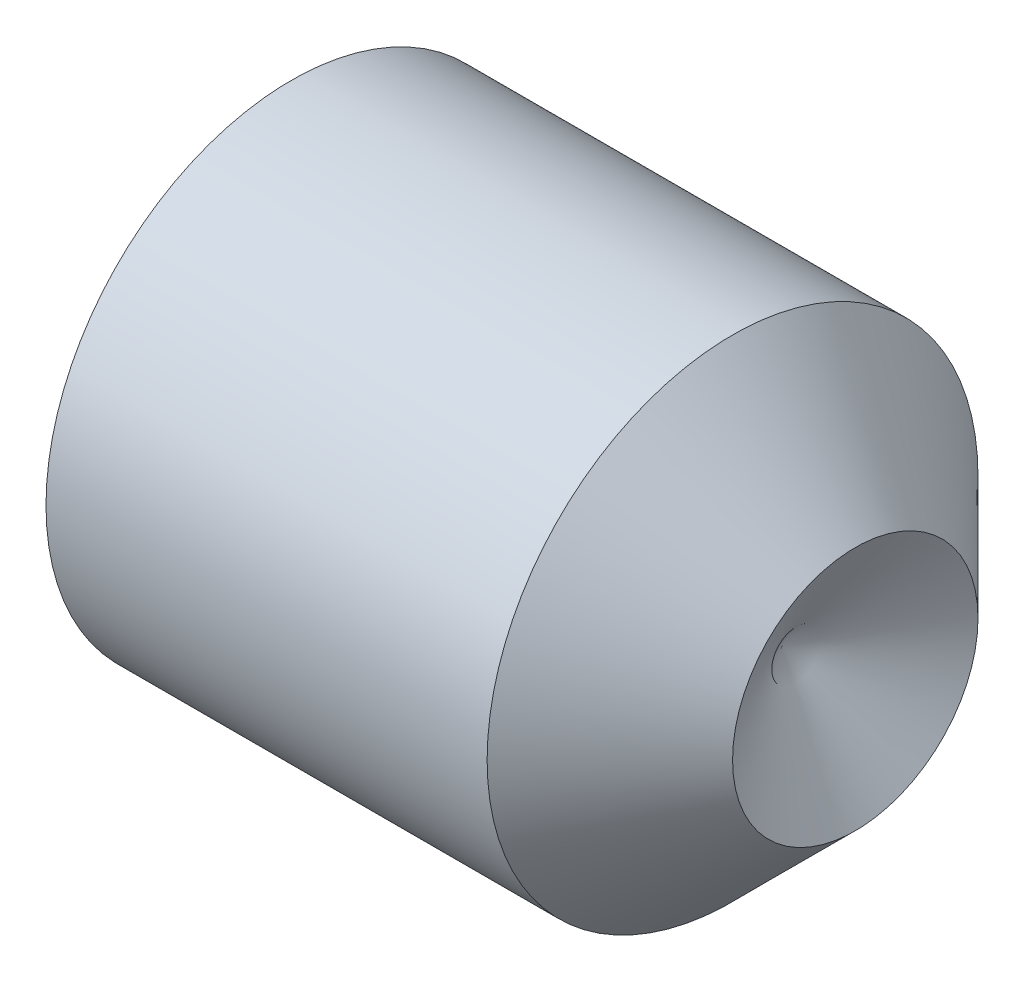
SolidWorks part; units mm, degrees
ref_plane "Plane1" through (0, 0, 0) normal (0, 0, 1) x (1, 0, 0)
ref_plane "Plane2" through (0, 0, 0) normal (0, 1, 0) x (1, 0, 0)
ref_plane "Plane3" through (0, 0, 0) normal (1, 0, 0) x (0, 0, -1)
revolve "BaseBody" add sketch "BodySke" angle 360 about L5
sketch "BodySke" plane through (0, 0, 0) normal (0, 0, 1) x (1, 0, 0)
  line L0 (0, 0) -> (0, 2.055)
  line L1 (0, 2.055) -> (0.2569, 2.5)
  line L2 (0.2569, 2.5) -> (4.75, 2.5)
  line L3 (4.75, 2.5) -> (6, 1.25)
  line L4 (5.2489, 0) -> (0, 0)
  line L5 (-12.7, 0) -> (88.9, 0) construction
  line L6 (5.2489, 0) -> (6, 1.25)
  line L7 (6, 1.25) -> (6, 10.775) construction
  line L8 (0, -2.055) -> (0.2569, -2.5) construction
  line L9 (5.2489, 0) -> (6, -1.25) construction
  line L10 (4.75, -2.5) -> (6, -1.25) construction
  line L11 (0.8, 15.875) -> (0.8, -3.175) construction
  dimension "Length" = 6
  dimension "Diameter" = 5
  dimension "Drive_ch_ang" = 60
  dimension "Minor_dia" = 4.11
  dimension "Cup_nose_ang" = 45
  dimension "Cup_ang" = 118
  dimension "Cup_dia" = 2.5
  dimension "Advance" = 0.8
sketch "Sketch2" plane through (0, 0, 0) normal (-1, 0, 0) x (0, 0, 1)
  line L0 (0.7217, 1.25) -> (-0.7217, 1.25)
  line L1 (-0.7217, 1.25) -> (-1.4434, 0)
  line L2 (0.7217, 1.25) -> (1.4434, 0)
  line L3 (0.7217, -1.25) -> (1.4434, 0)
  line L4 (0.7217, -1.25) -> (-0.7217, -1.25)
  line L5 (-0.7217, -1.25) -> (-1.4434, 0)
  dimension "Hex_size" = 2.5
  dimension "D2" = 1.25
  dimension "D3" = 1.25
extrude "Hex" cut sketch "Sketch2" against normal blind 2.7
sketch "Sketch4" plane through (0, 4.7709, -0.5249) normal (-1, 0, 0) x (0, 0, 1)
  line L0 (0.5249, -4.7709) -> (1.9854, -4.7709)
  line L1 (0.5249, -4.7709) -> (6.6732, -1.2211) construction
  line L2 (0.5249, -4.7709) -> (1.2551, -3.506)
  line L3 (1.7257, -4.4442) -> (1.9182, -4.333)
  line L4 (1.4082, -3.8943) -> (1.6007, -3.7831)
  arc A0 (1.7257, -4.4442) -> (1.4082, -3.8943) centre (0.5249, -4.7709) ccw
  arc A1 (1.9854, -4.7709) -> (1.9182, -4.333) centre (0.5249, -4.7709) ccw
  arc A2 (1.2551, -3.506) -> (1.6007, -3.7831) centre (0.5249, -4.7709) cw
  circle A3 centre (0.5249, -4.7709) radius 1.2445 construction
  circle A4 centre (0.5249, -4.7709) radius 1.4605 construction
  dimension "D1" = 30
  dimension "Spline_n_dim" = 2.489
  dimension "Spline_m_dim" = 2.921
  dimension "Spline_a_dim" = 60
  dimension "D3" = 0.3175
  dimension "Spline_p_dim" = 0.635
extrude "Spline6" cut sketch "Sketch4" against normal blind 2.3
pattern_circular "CirPattern1" count 6 every 60 about axis through (-12.7, 0, 0) along (1, 0, 0)
sketch "Sketch5" plane through (0, 1.5227, 6.1981) normal (-1, 0, 0) x (0, 0, 1)
  line L0 (-6.1981, -1.5227) -> (-4.7376, -1.5227)
  line L1 (-6.1981, -1.5227) -> (-1.178, 3.4975) construction
  line L2 (-6.1981, -1.5227) -> (-6.1981, -0.0622)
  line L3 (-5.0936, -0.8672) -> (-4.9655, -0.7391)
  line L4 (-5.5426, -0.4182) -> (-5.4146, -0.2901)
  line L5 (-5.5426, -0.4182) -> (-5.0936, -0.8672)
  arc A1 (-4.7376, -1.5227) -> (-4.9655, -0.7391) centre (-6.1981, -1.5227) ccw
  arc A2 (-6.1981, -0.0622) -> (-5.4146, -0.2901) centre (-6.1981, -1.5227) cw
  circle A3 centre (-6.1981, -1.5227) radius 1.2445 construction
  circle A4 centre (-6.1981, -1.5227) radius 1.4605 construction
  dimension "D1" = 45
  dimension "Spline_n_dim" = 2.489
  dimension "Spline_m_dim" = 2.921
  dimension "Spline_a_dim" = 90
  dimension "D3" = 0.3175
  dimension "Spline_p_dim" = 0.635
extrude "Spline4" cut sketch "Sketch5" against normal blind 2.3
pattern_circular "CirPattern2" count 4 every 90 about axis through (-12.7, 0, 0) along (1, 0, 0)
sketch "ThdSchSke" plane through (0, 0, 0) normal (0, 0, 1) x (1, 0, 0)
  line L0 (0.2569, -2.055) -> (-0.0547, -2.5)
  line L1 (0.2569, -2.055) -> (0.5685, -2.5)
  line L2 (0.5685, -2.5) -> (0.5685, -3.125)
  line L3 (-3.175, 0) -> (5.1513, 0) construction
  line L4 (0.2569, 2.5) -> (0.2569, -2.5) construction
  line L5 (0.5685, -3.125) -> (-0.0547, -3.125)
  line L6 (-0.0547, -3.125) -> (-0.0547, -2.5)
  dimension "Thread_minor" = 4.11
  dimension "Diameter" = 5
  dimension "SideAngle" = 55
  dimension "VeeAngle" = 70
  dimension "Overcut" = 6.25
revolve "ThreadSchematic" cut sketch "ThdSchSke" angle 360 about L3
pattern_linear "ThdSchPat"
equation "\"D2@Sketch2\" = \"Hex_size@Sketch2\" / 2"
equation "\"D3@Sketch2\" = \"Hex_size@Sketch2\" / 2"
equation "\"Thread_minor@ThreadCosmetic\" = \"Minor_dia@BodySke\""
equation "\"D1@Sketch4\" = \"Spline_a_dim@Sketch4\" / 2"
equation "\"D3@Sketch4\" = \"Spline_p_dim@Sketch4\" / 2"
equation "\"D2@CirPattern1\" = \"Spline_a_dim@Sketch4\""
equation "\"Num_teeth@CirPattern1\" = 360 / \"D2@CirPattern1\""
equation "\"Spline_a_dim@Sketch5\" = 90"
equation "\"Spline_p_dim@Sketch5\" = \"Spline_p_dim@Sketch4\""
equation "\"Spline_m_dim@Sketch5\" = \"Spline_m_dim@Sketch4\""
equation "\"Spline_n_dim@Sketch5\" = \"Spline_n_dim@Sketch4\""
equation "\"D1@Sketch5\" = \"Spline_a_dim@Sketch5\" / 2"
equation "\"D3@Sketch5\" = \"Spline_p_dim@Sketch5\" / 2"
equation "\"Key_eng@Spline4\" = \"Key_eng@Spline6\""
equation "\"Thread_minor@ThdSchSke\" = \"Thread_minor@ThreadCosmetic\""
equation "\"Diameter@ThdSchSke\" = \"Diameter@BodySke\""
equation "\"Overcut@ThdSchSke\" = \"Diameter@BodySke\" * 1.25"
equation "\"Num_threads@ThdSchPat\" = int( (\"Length@BodySke\" - ( ( ( \"Diameter@BodySke\" - \"Minor_dia@BodySke\" ) * 0.5 ) / tan( \"Drive_ch_ang@BodySke\" * 0.017453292 ) ) - ( ( ( \"Diameter@BodySke\" - \"Cup_dia@BodySk"
equation "\"Advance@ThdSchPat\" = (\"Length@BodySke\" - ( ( ( \"Diameter@BodySke\" - \"Minor_dia@BodySke\" ) * 0.5 ) / tan( \"Drive_ch_ang@BodySke\" * 0.017453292 ) ) - ( ( ( \"Diameter@BodySke\" - \"Cup_dia@BodySke\" ) * 0."
equation "' \"Num_threads@ThdSchPat\" = \"Num_threads@ThdSchPat\" - sgn( \"Num_threads@ThdSchPat\" - 1) '---chamfered tips only---"
